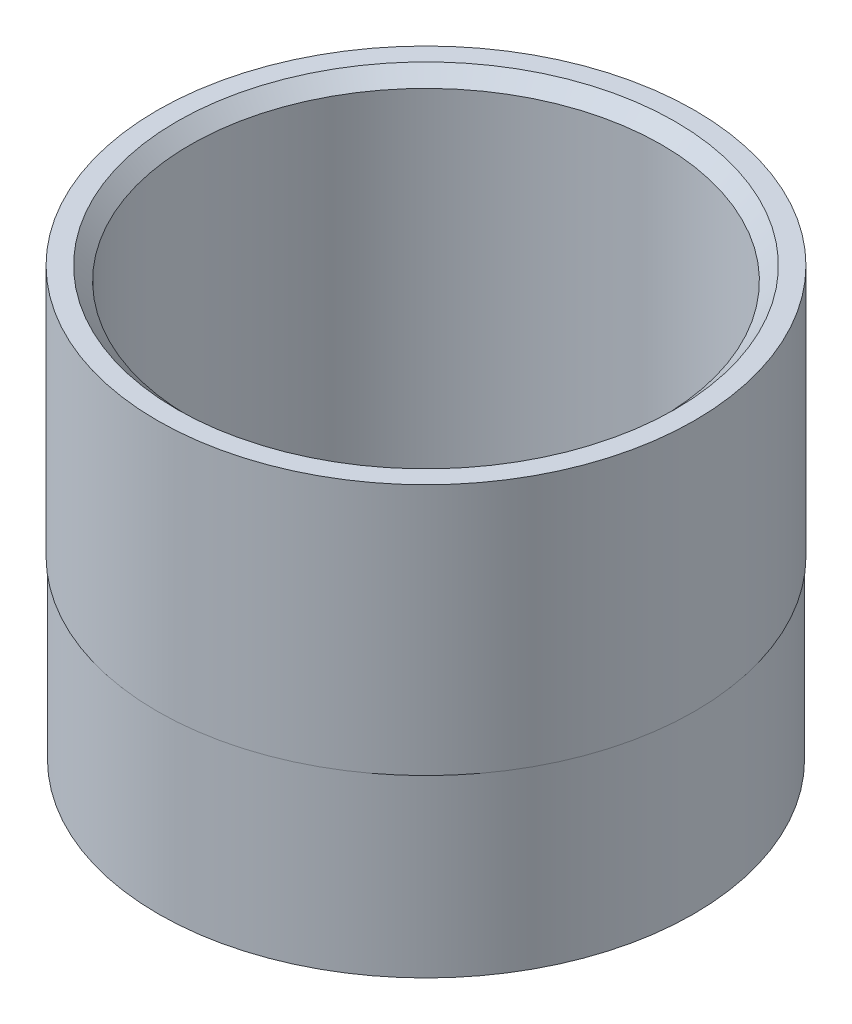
SolidWorks part; units mm, degrees
ref_plane "Front Plane" through (0, 0, 0) normal (0, 0, 1) x (1, 0, 0)
ref_plane "Top Plane" through (0, 0, 0) normal (0, 1, 0) x (1, 0, 0)
ref_plane "Right Plane" through (0, 0, 0) normal (1, 0, 0) x (0, 0, -1)
sketch "Sketch1" plane through (0, 0, 0) normal (0, 0, 1) x (1, 0, 0)
  line L0 (0, 0) -> (0, 8.3738) construction
  line L1 (-44.577, 78.359) -> (-47.117, 80.899)
  line L2 (-47.117, 0) -> (-50.6095, 0)
  line L3 (-44.577, 2.54) -> (-44.577, 78.359)
  line L4 (-47.117, 80.899) -> (-50.6095, 80.899)
  line L5 (-50.6095, 0) -> (-50.6095, 80.899)
  line L7 (-50.6095, 80.899) -> (-50.6095, 33.274)
  line L10 (-44.577, 2.54) -> (-47.117, 0)
  point P3 (-44.577, 0)
  point P5 (-44.577, 80.899)
  dimension "D1" = 6.0325
  dimension "D2" = 80.899
  dimension "D3" = 44.577
revolve "Revolve1" add sketch "Sketch1" angle 360 about L0
sketch "Sketch2" plane through (0, 80.899, 0) normal (0, 1, 0) x (1, 0, 0)
  circle A0 centre (0, 0) radius 50.8
  circle A1 centre (0, 0) radius 50.6095
extrude "Boss-Extrude1" add sketch "Sketch2" against normal blind 47.625
